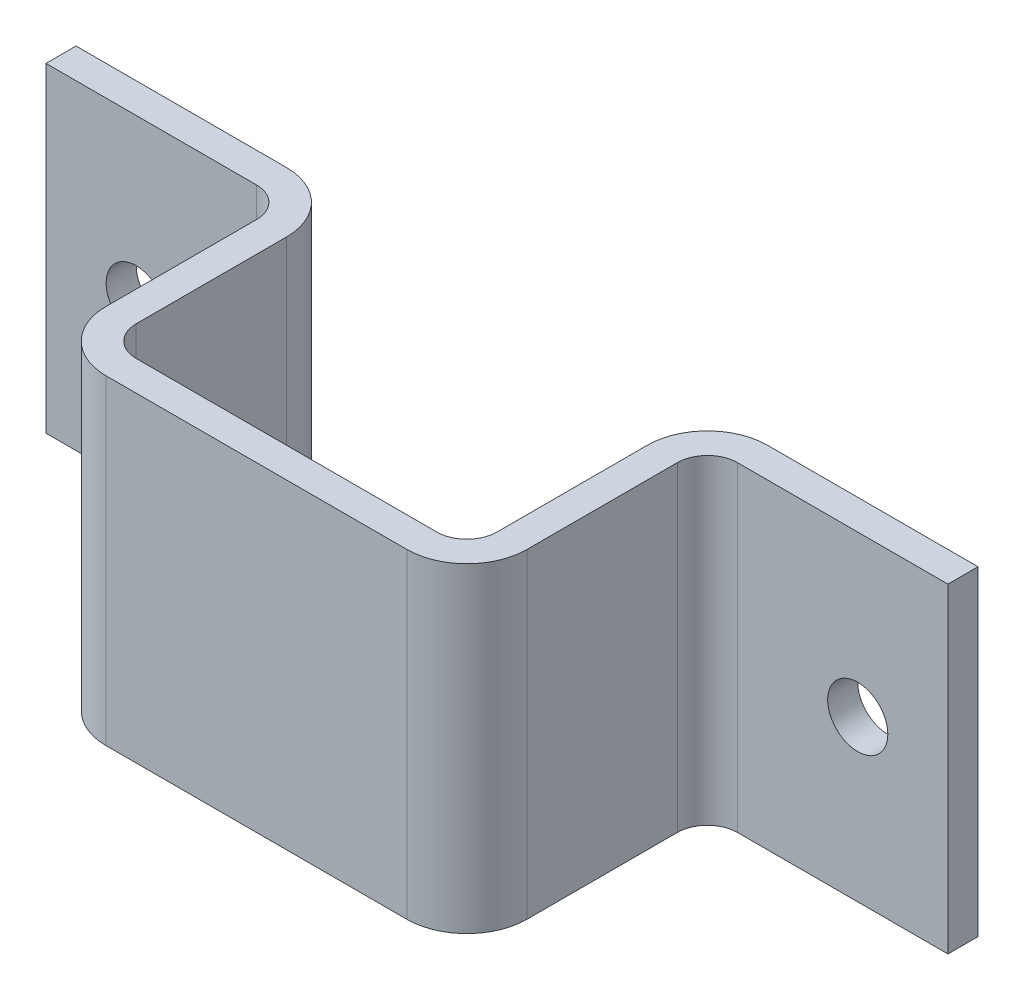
SolidWorks part; units mm, degrees
ref_plane "Front" through (0, 0, 0) normal (0, 0, 1) x (1, 0, 0)
ref_plane "Top" through (0, 0, 0) normal (0, 1, 0) x (1, 0, 0)
ref_plane "Right" through (0, 0, 0) normal (1, 0, 0) x (0, 0, -1)
sketch "Sketch2" plane through (0, 0, 0) normal (0, 1, 0) x (-1, 0, 0)
  line L0 (-75, 0) -> (-30, 0)
  line L1 (-75, 0) -> (75, 0) construction
  line L2 (-30, 0) -> (-30, 40)
  line L3 (-30, 40) -> (30, 40)
  line L4 (0, 47.3204) -> (0, -33.4471) construction
  line L5 (30, 0) -> (30, 40)
  line L6 (75, 0) -> (30, 0)
  point P10 (0, 40)
  dimension "D1" = 30
  dimension "D2" = 40
  dimension "D3" = 45
extrude "Extrude-Thin1" add sketch "Sketch2" along normal mid plane 53.2697 thin
sketch "Sketch3" plane through (0, 0, 5) normal (0, 0, 1) x (1, 0, 0)
  line L0 (75, 26.6348) -> (75, -26.6348) construction
  circle A0 centre (60, 0) radius 5
  dimension "D2" = 10
  dimension "D1" = 15
extrude "Cut-Extrude1" cut sketch "Sketch3" against normal through all
pattern_linear "LPattern1" count 2 spacing 120
